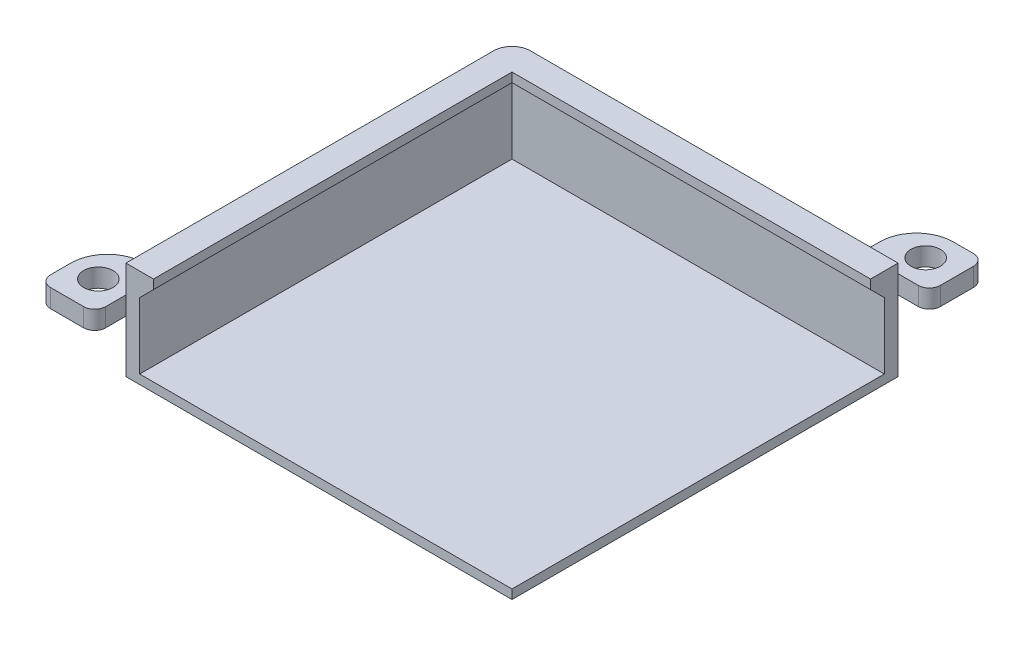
SolidWorks part; units mm, degrees
ref_plane "Front Plane" through (0, 0, 0) normal (0, 0, 1) x (1, 0, 0)
ref_plane "Top Plane" through (0, 0, 0) normal (0, 1, 0) x (1, 0, 0)
ref_plane "Right Plane" through (0, 0, 0) normal (1, 0, 0) x (0, 0, -1)
sketch "Sketch1" plane through (0, 0, 0) normal (0, 1, 0) x (1, 0, 0)
  line L1 (-105, -105) -> (105, -105)
  line L2 (-105, -105) -> (-105, 105)
  line L3 (-105, 105) -> (105, 105)
  line L4 (105, -105) -> (105, 105)
  line L5 (-105, -105) -> (105, 105) construction
  line L6 (-105, 105) -> (105, -105) construction
  point P0 (0, 0)
  dimension "D1" = 210
  dimension "D2" = 210
extrude "Boss-Extrude1" add sketch "Sketch1" along normal blind 5
sketch "Sketch2" plane through (0, 0, 105) normal (0, 0, 1) x (1, 0, 0)
  line L0 (-97.5, 41) -> (-90, 48.5)
  line L1 (-105, 5) -> (-97.5, 5)
  line L2 (-105, 5) -> (-105, 41)
  line L3 (-105, 41) -> (-97.5, 41)
  line L4 (-97.5, 5) -> (-97.5, 41)
  line L5 (-105, 41) -> (-90, 41)
  line L6 (-105, 41) -> (-105, 48.5)
  line L7 (-105, 48.5) -> (-90, 48.5)
  line L8 (-90, 41) -> (-90, 48.5)
  dimension "D1" = 7.5
  dimension "D2" = 36
  dimension "D3" = 7.5
  dimension "D4" = 15
extrude "Boss-Extrude2" add sketch "Sketch2" against normal blind 210 contours L4 L3 L2 M5 | L7 L6 L3 L0
sketch "Sketch3" plane through (105, 0, 0) normal (1, 0, 0) x (0, 0, -1)
  line L0 (105, 41) -> (-105, 41) construction
  line L1 (105, 5) -> (97.5, 5)
  line L2 (105, 5) -> (105, 41)
  line L3 (105, 41) -> (97.5, 41)
  line L4 (97.5, 5) -> (97.5, 41)
  line L5 (105, 48.5) -> (-105, 48.5) construction
  line L6 (105, 41) -> (90, 41)
  line L7 (105, 41) -> (105, 48.5)
  line L8 (105, 48.5) -> (90, 48.5)
  line L9 (90, 41) -> (90, 48.5)
  line L10 (97.5, 41) -> (90, 48.5)
  dimension "D1" = 36
  dimension "D2" = 7.5
  dimension "D3" = 15
  dimension "D4" = 7.5
extrude "Boss-Extrude3" add sketch "Sketch3" against normal blind 210 contours L4 L2 L3 M7 | L10 L3 L7 L8
fillet "Fillet1" radius 10 1 edges at (-105, 24.25, -105)
sketch "Sketch4" plane through (0, 0, -105) normal (0, 0, -1) x (-1, 0, 0)
  line L1 (-105, 48.5) -> (-85, 48.5)
  line L2 (-105, 48.5) -> (-105, 38.5)
  line L3 (-105, 38.5) -> (-85, 38.5)
  line L4 (-85, 48.5) -> (-85, 38.5)
  dimension "D1" = 20
  dimension "D2" = 10
extrude "Boss-Extrude4" add sketch "Sketch4" along normal blind 10
sketch "Sketch10" plane through (0, 48.5, 0) normal (0, 1, 0) x (1, 0, 0)
  line L0 (105, 115) -> (105, 135)
  line L1 (85, 115) -> (105, 115)
  line L3 (105, 105) -> (125, 105)
  line L4 (105, 105) -> (105, 135)
  line L5 (105, 135) -> (125, 135)
  line L6 (125, 105) -> (125, 135)
  arc A0 (105, 135) -> (85, 115) centre (105, 115) ccw
  dimension "D2" = 20
  dimension "D3" = 30
  dimension "D1" = 20
  dimension "D4" = 20
extrude "Boss-Extrude9" add sketch "Sketch10" against normal blind 10 contours L3 L6 L5 L0 M10 | L0 A0 M11
sketch "Sketch12" plane through (-105, 0, 0) normal (-1, 0, 0) x (0, 0, 1)
  line L1 (105, 48.5) -> (85, 48.5) construction
  line L2 (105, 48.5) -> (105, 38.5) construction
  line L3 (105, 38.5) -> (85, 38.5) construction
  line L4 (85, 48.5) -> (85, 38.5) construction
  line L5 (105, 38.5) -> (85, 38.5)
  line L6 (105, 38.5) -> (105, 28.5)
  line L7 (105, 28.5) -> (85, 28.5)
  line L8 (85, 38.5) -> (85, 28.5)
  dimension "D1" = 10
  dimension "D2" = 20
  dimension "D3" = 10
extrude "Boss-Extrude10" add sketch "Sketch12" along normal blind 10
sketch "Sketch14" plane through (0, 38.5, 0) normal (0, 1, 0) x (1, 0, 0)
  line L0 (-115, -105) -> (-135, -105)
  line L2 (-135, -105) -> (-105, -105)
  line L3 (-135, -105) -> (-135, -125)
  line L4 (-135, -125) -> (-105, -125)
  line L5 (-105, -105) -> (-105, -125)
  arc A0 (-115, -85) -> (-135, -105) centre (-115, -105) ccw
  dimension "D1" = 20
  dimension "D2" = 30
  dimension "D3" = 20
extrude "Boss-Extrude12" add sketch "Sketch14" against normal blind 10 contours A0 L0 M6 | L5 L0 L3 L4 M7
sketch "Sketch15" plane through (0, 38.5, 0) normal (0, 1, 0) x (1, 0, 0)
  line L0 (-135, -105) -> (-120, -105) construction
  circle A0 centre (-120, -105) radius 8
  dimension "D2" = 16
  dimension "D1" = 15
extrude "Cut-Extrude4" cut sketch "Sketch15" against normal through all contours A0
sketch "Sketch16" plane through (0, 0, 125) normal (0, 0, 1) x (1, 0, 0)
  line L1 (-135, 38.5) -> (-105, 38.5)
  line L2 (-135, 38.5) -> (-135, 28.5)
  line L3 (-135, 28.5) -> (-105, 28.5)
  line L4 (-105, 38.5) -> (-105, 28.5)
extrude "Cut-Extrude5" cut sketch "Sketch16" against normal blind 3
sketch "Sketch17" plane through (125, 0, 0) normal (1, 0, 0) x (0, 0, -1)
  line L1 (105, 38.5) -> (135, 38.5)
  line L2 (105, 38.5) -> (105, 48.5)
  line L3 (105, 48.5) -> (135, 48.5)
  line L4 (135, 38.5) -> (135, 48.5)
extrude "Cut-Extrude6" cut sketch "Sketch17" against normal blind 3
sketch "Sketch18" plane through (0, 48.5, 0) normal (0, 1, 0) x (1, 0, 0)
  line L0 (105, 135) -> (105, 120)
  circle A0 centre (105, 120) radius 8
  dimension "D2" = 16
  dimension "D1" = 15
extrude "Cut-Extrude7" cut sketch "Sketch18" against normal through all
fillet "Fillet4" radius 6 4 edges at (-135, 33.5, 122) (-105, 33.5, 122) (122, 43.5, -105) (122, 43.5, -135)
sketch "Sketch19" plane through (0, 48.5, 0) normal (0, 1, 0) x (1, 0, 0)
  line L0 (-105, -105) -> (-90, -105)
  line L1 (-90, -105) -> (-90, 90)
  line L2 (-90, 90) -> (105, 90)
  line L3 (105, 90) -> (105, 105)
  line L4 (105, 105) -> (-95, 105)
  line L5 (-105, -105) -> (-105, 95)
  arc A0 (-95, 105) -> (-105, 95) centre (-95, 95) ccw
extrude "Boss-Extrude13" add sketch "Sketch19" along normal blind 5
scale "Scale1" bodies to scale 120 scale about centroid uniform scaling yes scale factor 0.9
